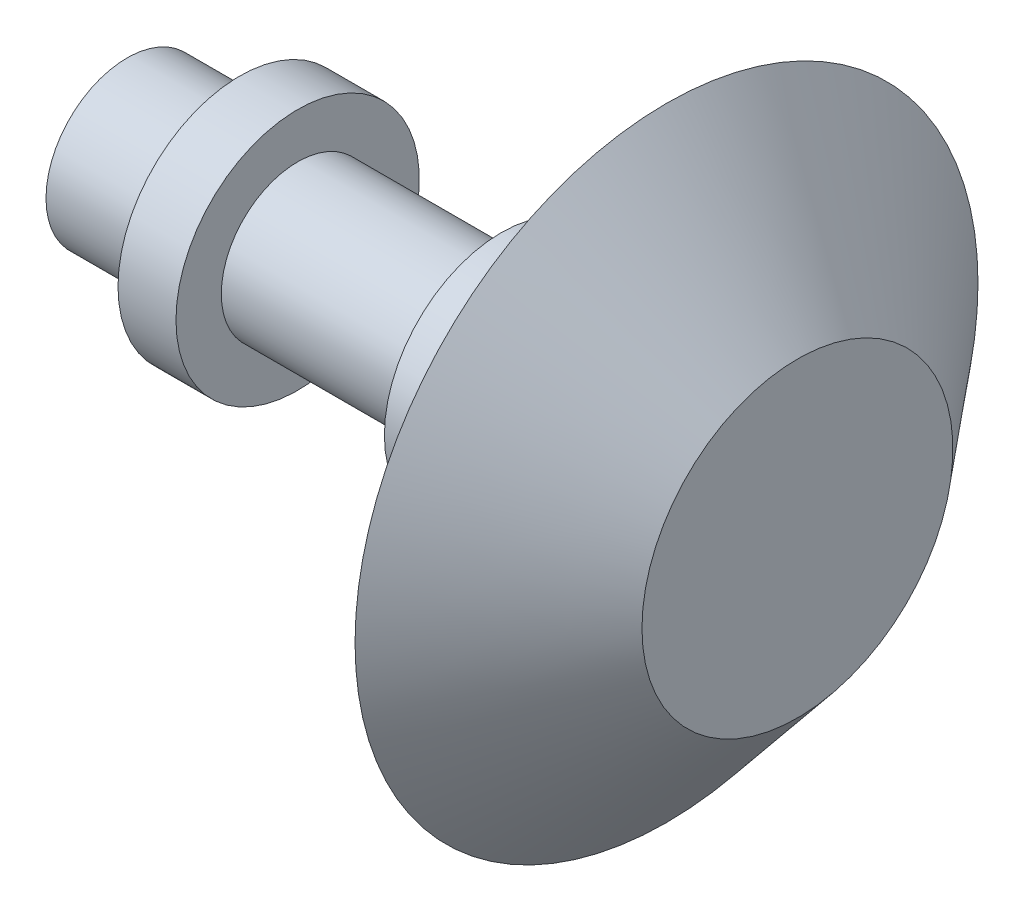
SolidWorks part; units mm, degrees
ref_plane "Plan de face" through (0, 0, 0) normal (0, 0, 1) x (1, 0, 0)
ref_plane "Plan de dessus" through (0, 0, 0) normal (0, 1, 0) x (1, 0, 0)
ref_plane "Plan de droite" through (0, 0, 0) normal (1, 0, 0) x (0, 0, -1)
sketch "Esquisse1" plane through (0, 0, 0) normal (0, 0, 1) x (1, 0, 0)
  line L0 (0, 0) -> (144.3981, 0) construction
  line L1 (131.6512, 0) -> (131.6512, 30.5352)
  line L2 (131.6512, 30.5352) -> (105.9391, 61.1777)
  line L3 (105.9391, 61.1777) -> (105.9391, 15)
  line L4 (105.9391, 15) -> (82.2571, 15)
  line L5 (82.2571, 15) -> (82.2571, 22.9668)
  line L6 (82.2571, 22.9668) -> (73.4936, 22.9668)
  line L7 (73.4936, 22.9668) -> (73.4936, 15)
  line L8 (73.4936, 15) -> (33.4936, 15)
  line L9 (33.4936, 15) -> (33.4936, 23.9004)
  line L10 (33.4936, 23.9004) -> (22.1078, 23.9004)
  line L11 (22.1078, 23.9004) -> (22.1078, 15.9336)
  line L12 (22.1078, 15.9336) -> (0, 15.9336)
  line L13 (0, 15.9336) -> (0, 0)
  line L14 (0, 0) -> (131.6512, 0)
  dimension "D1" = 15
revolve "Révolution1" add sketch "Esquisse1" angle 360 about L0
